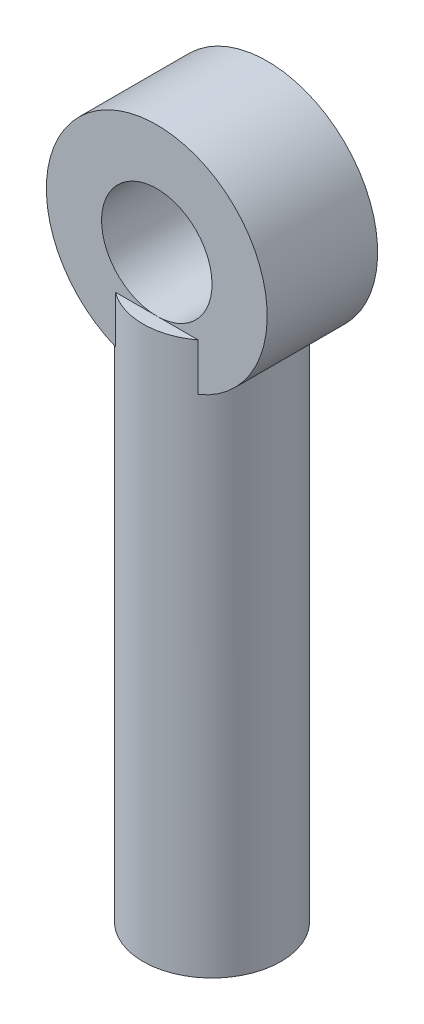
SolidWorks part; units mm, degrees
ref_plane "Front Plane" through (0, 0, 0) normal (0, 0, 1) x (1, 0, 0)
ref_plane "Top Plane" through (0, 0, 0) normal (0, 1, 0) x (1, 0, 0)
ref_plane "Right Plane" through (0, 0, 0) normal (1, 0, 0) x (0, 0, -1)
sketch "Sketch1" plane through (0, 0, 0) normal (0, 1, 0) x (1, 0, 0)
  circle A0 centre (0, 0) radius 1.5875
  dimension "D1" = 3.175
extrude "Extrude1" add sketch "Sketch1" along normal blind 12.7
sketch "Sketch2" plane through (0, 0, 0) normal (0, 0, 1) x (1, 0, 0)
  circle A0 centre (0, 13.97) radius 2.54
  circle A1 centre (0, 13.97) radius 1.27
  dimension "D1" = 2.54
  dimension "D2" = 5.08
  dimension "D3" = 13.97
extrude "Extrude2" add sketch "Sketch2" along normal mid plane 2.54
